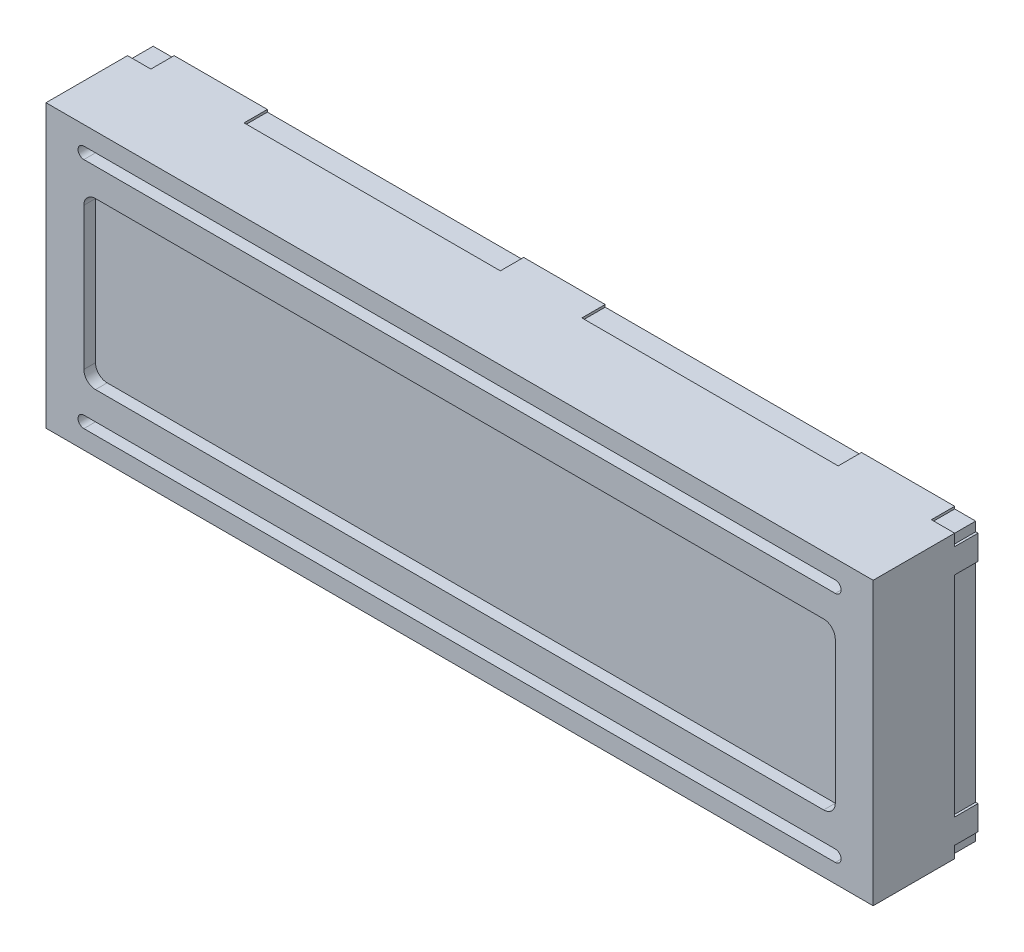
SolidWorks part; units mm, degrees
ref_plane "Plan de face" through (0, 0, 0) normal (0, 0, 1) x (1, 0, 0)
ref_plane "Plan de dessus" through (0, 0, 0) normal (0, 1, 0) x (1, 0, 0)
ref_plane "Plan de droite" through (0, 0, 0) normal (1, 0, 0) x (0, 0, -1)
sketch "Esquisse1" plane through (0, 0, 0) normal (0, 0, 1) x (1, 0, 0)
  line L0 (-43.4522, 0) -> (42.2721, 0) construction
  line L1 (-35.5, 12.1) -> (35.5, 12.1)
  line L2 (-35.5, 12.1) -> (-35.5, -12.1)
  line L3 (-35.5, -12.1) -> (35.5, -12.1)
  line L4 (35.5, 12.1) -> (35.5, -12.1)
  line L5 (0, -15.1886) -> (0, 13.5982) construction
  dimension "D1" = 71
  dimension "D2" = 24.2
extrude "Boss.-Extru.1" add sketch "Esquisse1" along normal blind 9
sketch "Esquisse2" plane through (0, 0, 9) normal (0, 0, 1) x (1, 0, 0)
  line L0 (-40.6999, 0) -> (38.4346, 0) construction
  line L1 (0, 15.5173) -> (0, -14.0826) construction
  line L3 (-31.25, 7.1) -> (31.25, 7.1)
  line L4 (-32.25, 6.1) -> (-32.25, -6.1)
  line L5 (-31.25, -7.1) -> (31.25, -7.1)
  line L6 (32.25, 6.1) -> (32.25, -6.1)
  arc A0 (31.25, 7.1) -> (32.25, 6.1) centre (31.25, 6.1) cw
  arc A1 (31.25, -7.1) -> (32.25, -6.1) centre (31.25, -6.1) ccw
  arc A2 (-32.25, -6.1) -> (-31.25, -7.1) centre (-31.25, -6.1) ccw
  arc A3 (-31.25, 7.1) -> (-32.25, 6.1) centre (-31.25, 6.1) ccw
  dimension "D3" = 1
  dimension "D1" = 64.5
  dimension "D2" = 14.2
extrude "Enlèv. mat.-Extru.1" cut sketch "Esquisse2" against normal blind 1
sketch "Esquisse3" plane through (0, 0, 9) normal (0, 0, 1) x (1, 0, 0)
  line L0 (-37.9132, 10) -> (38.4273, 10) construction
  line L1 (0, -15.0642) -> (0, 14.3091) construction
  line L2 (-32.25, 10) -> (32.25, 10) construction
  line L3 (-32.25, 10.5) -> (32.25, 10.5)
  line L4 (-32.25, 9.5) -> (32.25, 9.5)
  line L7 (-32.25, 6.1) -> (-32.25, -6.1) construction
  line L8 (-37.0017, 0) -> (36.9771, 0) construction
  line L9 (-32.25, -10) -> (32.25, -10) construction
  line L10 (-32.25, -10.5) -> (32.25, -10.5)
  line L11 (-32.25, -9.5) -> (32.25, -9.5)
  line L12 (-37.9132, -10) -> (38.4273, -10) construction
  arc A0 (-32.25, 10.5) -> (-32.25, 9.5) centre (-32.25, 10) ccw
  arc A1 (32.25, 9.5) -> (32.25, 10.5) centre (32.25, 10) ccw
  arc A2 (-32.25, -10.5) -> (-32.25, -9.5) centre (-32.25, -10) cw
  arc A3 (32.25, -9.5) -> (32.25, -10.5) centre (32.25, -10) cw
  point P7 (0, 10)
  point P19 (0, -10)
  dimension "D1" = 1
  dimension "D2" = 10
extrude "Enlèv. mat.-Extru.2" cut sketch "Esquisse3" against normal blind 1
sketch "Esquisse4" plane through (0, -12.1, 0) normal (0, -1, 0) x (1, 0, 0)
  line L0 (0, -5.3669) -> (0, 15.0474) construction
  line L1 (3.5, 2) -> (3.5, -2)
  line L2 (-25.5, 2) -> (-3.5, 2)
  line L3 (-25.5, 2) -> (-25.5, -2)
  line L4 (-25.5, -2) -> (-3.5, -2)
  line L5 (-3.5, 2) -> (-3.5, -2)
  line L6 (25.5, 2) -> (3.5, 2)
  line L7 (25.5, -2) -> (3.5, -2)
  line L8 (25.5, 2) -> (25.5, -2)
  line L9 (-35.5, 9) -> (-35.5, 0) construction
  line L10 (37.5, 2) -> (37.5, -2)
  line L11 (37.5, -2) -> (33.5, -2)
  line L12 (33.5, 2) -> (33.5, -2)
  line L13 (37.5, 2) -> (33.5, 2)
  line L14 (-37.5, 2) -> (-33.5, 2)
  line L15 (-37.5, 2) -> (-37.5, -2)
  line L16 (-37.5, -2) -> (-33.5, -2)
  line L17 (-33.5, 2) -> (-33.5, -2)
  point P11 (0, 0)
  dimension "D1" = 22
  dimension "D2" = 3.5
  dimension "D3" = 2
  dimension "D4" = 4
  dimension "D5" = 2
  dimension "D6" = 4
extrude "Enlèv. mat.-Extru.3" cut sketch "Esquisse4" against normal blind 0.2
mirror "Symétrie1" about plane through (0, 0, 0) normal (0, 1, 0) of "Enlèv. mat.-Extru.3"
sketch "Esquisse5" plane through (35.5, 0, 0) normal (1, 0, 0) x (0, 0, -1)
  line L0 (3.204, 0) -> (-10.87, 0) construction
  line L1 (-2, 12.1) -> (2, 12.1)
  line L2 (-2, 12.1) -> (-2, 11.1)
  line L3 (-2, 11.1) -> (2, 11.1)
  line L4 (2, 12.1) -> (2, 11.1)
  line L5 (0, -11.9) -> (0, 11.9) construction
  line L6 (-2, 9) -> (2, 9)
  line L7 (-2, 9) -> (-2, -9)
  line L8 (-2, -9) -> (2, -9)
  line L9 (2, 9) -> (2, -9)
  line L10 (2, -12.1) -> (2, -11.1)
  line L11 (-2, -12.1) -> (2, -12.1)
  line L12 (-2, -12.1) -> (-2, -11.1)
  line L13 (-2, -11.1) -> (2, -11.1)
  dimension "D1" = 2
  dimension "D2" = 4
  dimension "D3" = 1
  dimension "D4" = 18
extrude "Enlèv. mat.-Extru.4" cut sketch "Esquisse5" against normal blind 0.2
mirror "Symétrie2" about plane through (0, 0, 0) normal (1, 0, 0) of "Enlèv. mat.-Extru.4"
